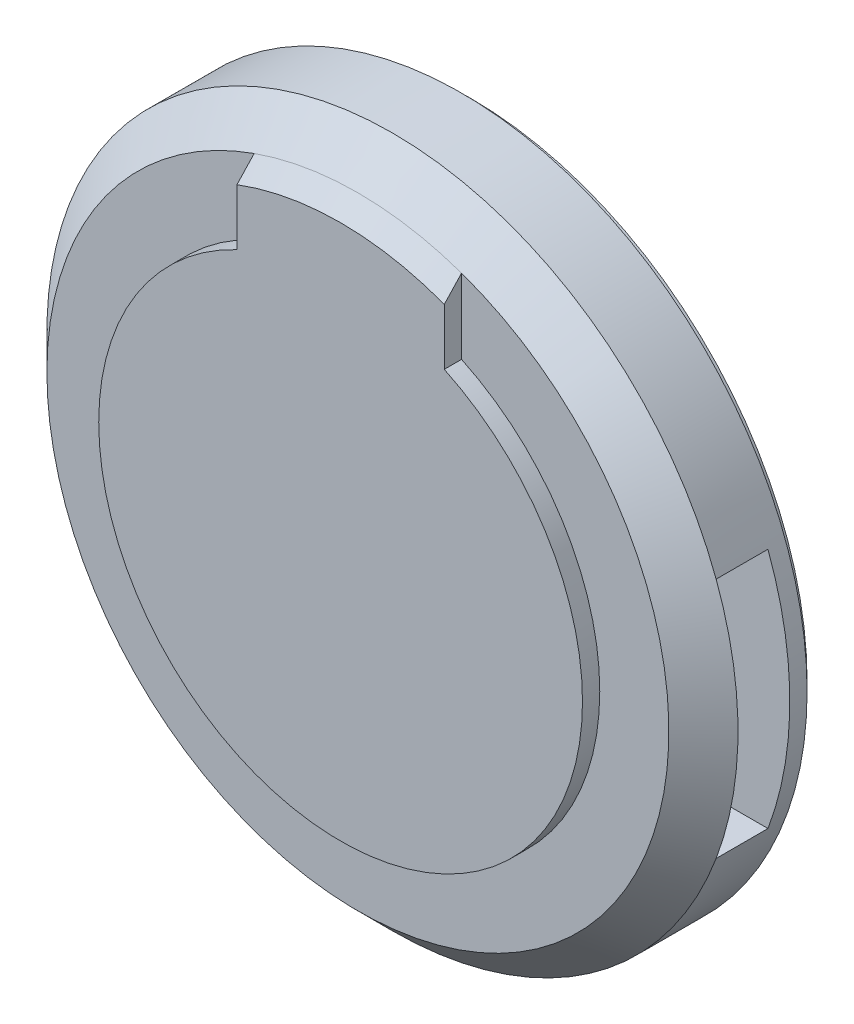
SolidWorks part; units mm, degrees
ref_plane "Plan de face" through (0, 0, 0) normal (0, 0, 1) x (1, 0, 0)
ref_plane "Plan de dessus" through (0, 0, 0) normal (0, 1, 0) x (1, 0, 0)
ref_plane "Plan de droite" through (0, 0, 0) normal (1, 0, 0) x (0, 0, -1)
sketch "Esquisse1" plane through (0, 0, 0) normal (0, 0, 1) x (1, 0, 0)
  circle A0 centre (0, 0) radius 20
  dimension "D1" = 40
extrude "Boss.-Extru.1" add sketch "Esquisse1" along normal blind 6
chamfer "Chanfrein1" distance 2 distance2 2 1 edges at (20, 0, 6)
sketch "Esquisse2" plane through (0, 0, 0) normal (0, 0, -1) x (-1, 0, 0)
  circle A2 centre (0, 0) radius 19.5
  circle A3 centre (0, 0) radius 19.5
  dimension "D1" = 0.5
extrude "Boss.-Extru.2" add sketch "Esquisse2" along normal blind 0.5
sketch "Esquisse3" plane through (0, 0, -0.5) normal (0, 0, -1) x (-1, 0, 0)
  text T0 "OM" font "Arial Narrow" height in points 20
extrude "Enlèv. mat.-Extru.1" cut sketch "Esquisse3" against normal blind 0.5
sketch "Esquisse4" plane through (0, 0, 6) normal (0, 0, 1) x (1, 0, 0)
  line L0 (0, 0) -> (0, 21.3746) construction
  line L1 (-6, 12.6491) -> (-6, 16.9706)
  line L2 (6, 12.6491) -> (6, 16.9706)
  arc A0 (-6, 12.6491) -> (6, 12.6491) centre (0, 0) ccw
  circle A1 centre (0, 0) radius 18 construction
  arc A2 (6, 16.9706) -> (-6, 16.9706) centre (0, 0) ccw
  dimension "D1" = 28
  dimension "D2" = 12
extrude "Boss.-Extru.3" add sketch "Esquisse4" along normal blind 1
chamfer "Chanfrein2" distance 1 angle 45 1 edges at (0, 18, 7)
ref_plane "Plan1" through (20, 0, 0) normal (1, 0, 0) x (0, 0, -1)
sketch "Esquisse5" plane through (20, 0, 0) normal (1, 0, 0) x (0, 0, -1)
  line L0 (-15.6769, 0) -> (16.7322, 0) construction
  line L1 (0.5, -19.5) -> (0.5, 19.5) construction
  line L2 (-4, 7) -> (-1, 7)
  line L3 (-4, 7) -> (-4, -7)
  line L4 (-4, -7) -> (-1, -7)
  line L5 (-1, 7) -> (-1, -7)
  dimension "D1" = 14
  dimension "D2" = 3
  dimension "D3" = 1.5
extrude "Enlèv. mat.-Extru.2" cut sketch "Esquisse5" against normal through all
